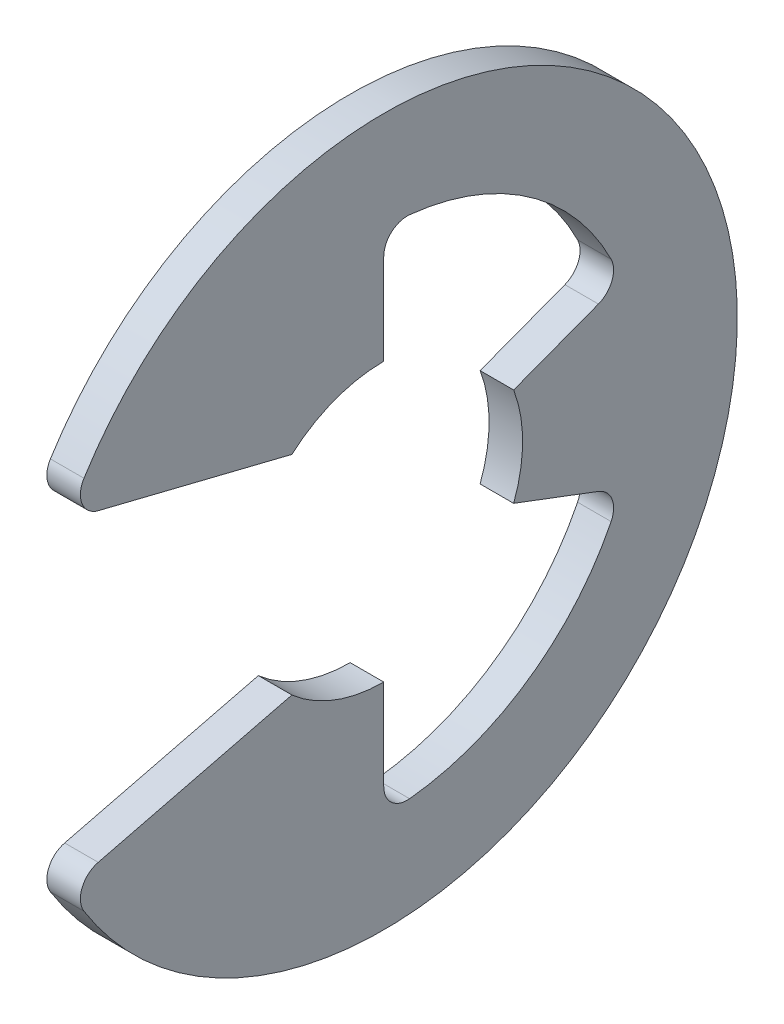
SolidWorks part; units mm, degrees
ref_plane "Front" through (0, 0, 0) normal (0, 0, 1) x (1, 0, 0)
ref_plane "Top" through (0, 0, 0) normal (0, 1, 0) x (1, 0, 0)
ref_plane "Right" through (0, 0, 0) normal (1, 0, 0) x (0, 0, -1)
sketch "Sketch1" plane through (0, 0, 0) normal (1, 0, 0) x (0, 0, -1)
  line L0 (-5.9715, -3.0225) -> (-1.7389, -1.9717)
  line L1 (-5.9715, 3.0225) -> (-1.7389, 1.9717)
  line L2 (0, -2.6289) -> (0, -4.8113)
  line L3 (0, 2.6289) -> (0, 4.8113)
  line L4 (2.4591, -0.9295) -> (4.5005, -1.701)
  line L5 (2.4591, 0.9295) -> (4.5005, 1.701)
  line L6 (0, 0) -> (-6.858, 0) construction
  line L7 (2.4591, 0.9295) -> (2.4591, -0.9295) construction
  line L8 (0, -2.6289) -> (-1.7389, -1.9717) construction
  line L9 (0, 6.6929) -> (0, -6.6929) construction
  circle A1 centre (0, 0) radius 6.858 construction
  circle A2 centre (0, 0) radius 2.6289 construction
  arc A3 (-5.9715, -3.0225) -> (-5.9715, 3.0225) centre (0, 0) ccw
  arc A4 (-1.7389, -1.9717) -> (0, -2.6289) centre (0, 0) ccw
  arc A5 (-1.7389, 1.9717) -> (0, 2.6289) centre (0, 0) cw
  arc A6 (2.4591, 0.9295) -> (2.4591, -0.9295) centre (0, 0) cw
  arc A7 (0, -4.8113) -> (4.5005, -1.701) centre (0, 0) ccw
  arc A8 (4.5005, 1.701) -> (0, 4.8113) centre (0, 0) ccw
  dimension "D1" = 4.8113
  dimension "OD" = 13.3858
  dimension "L" = 13.716
  dimension "D" = 5.2578
  dimension "D2" = 2.9892
  dimension "D3" = 3.9434
extrude "Extrude1" add sketch "Sketch1" along normal mid plane 0.635
fillet "Fillet1" radius 0.4445 6 edges at (0, -4.8113, 0) (0, 4.8113, 0) (0, -3.0225, 5.9715) (0, 3.0225, 5.9715) (0, -1.701, -4.5005) (0, 1.701, -4.5005)
sketch "Sketch3" plane through (0, 0, 0) normal (0, 1, 0) x (1, 0, 0)
  line L0 (0.3683, 3.175) -> (0.3683, 2.667)
  line L1 (0.3683, 2.667) -> (-0.3683, 2.667)
  line L2 (-0.3683, 2.667) -> (-0.3683, 3.175)
  line L3 (-0.3683, 3.175) -> (-7.9185, 3.175)
  line L4 (3.1306, 0) -> (3.1306, 2.921)
  line L5 (-7.9185, 3.175) -> (-7.9185, 0)
  line L6 (-7.9185, 0) -> (3.1306, 0)
  line L8 (3.1306, 0) -> (3.1306, 3.175) construction
  line L9 (3.1306, 3.175) -> (0.3683, 3.175) construction
  line L10 (3.1306, 0) -> (17.2631, 0) construction
  line L11 (3.1306, 2.921) -> (2.8765, 3.175)
  line L12 (2.8765, 3.175) -> (0.3683, 3.175)
  point P2 (0, 2.667)
  point P5 (0.3683, 2.921)
  dimension "D1" = 2.7622
  dimension "Ds" = 6.35
  dimension "Dg" = 5.334
  dimension "W" = 0.7366
  dimension "D2" = 11.049
  dimension "D3" = 45
revolve "Revolve2" [suppressed] add sketch "Sketch3" angle 360 about L10
equation "\"D2@Sketch3\" = \"W@Sketch3\"*15"
equation "\"D1@Sketch3\" = \"D2@Sketch3\"/4"
equation "\"D1@Sketch1\" = (\"OD@Sketch1\"+\"D@Sketch1\")/3.875"
equation "\"D3@Sketch1\" = \"D@Sketch1\"*.75"
equation "\"D1@Fillet1\" = \"D1@Extrude1\"*.7"
